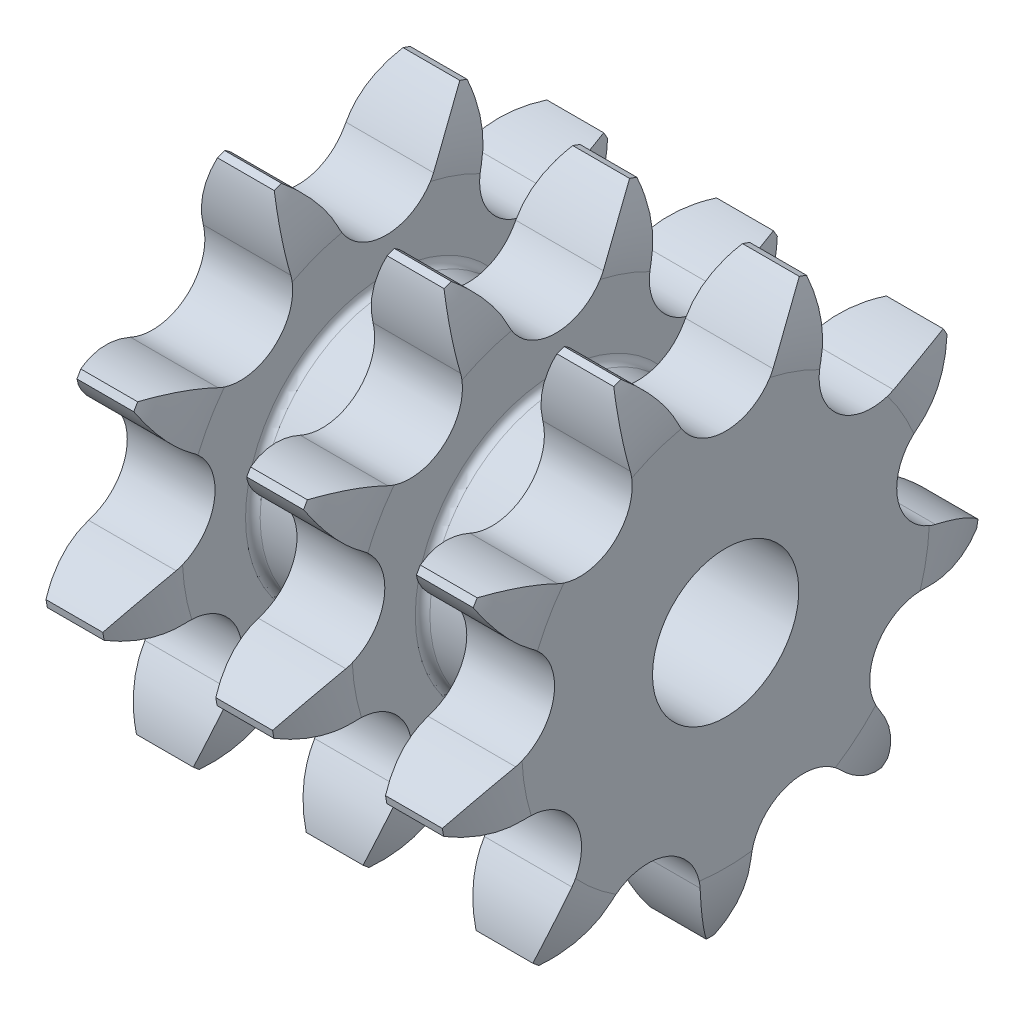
SolidWorks part; units mm, degrees
ref_plane "Plane1" through (0, 0, 0) normal (0, 0, 1) x (1, 0, 0)
ref_plane "Plane2" through (0, 0, 0) normal (0, 1, 0) x (1, 0, 0)
ref_plane "Plane3" through (0, 0, 0) normal (1, 0, 0) x (0, 0, -1)
sketch "Clipboard" plane through (0, 0, 0) normal (0, 1, 0) x (1, 0, 0)
  line L0 (0, 0) -> (12.5436, -1.9867)
  line L1 (-15, 0) -> (100, 0) construction
  line L2 (0, 0) -> (-0.8416, 0.9512)
  line L3 (0, 0) -> (-11.863, 4.5341)
  line L4 (0, 0) -> (3.0618, 0.4849)
  line L5 (0, 0) -> (-2.8109, -1.0484)
  line L6 (0, 0) -> (-29.0469, -19.598)
  line L7 (-0.8416, 0.9512) -> (35.5852, 8.6939)
  line L8 (-76.2, 38.1) -> (-75.2, 38.1)
  line L9 (-73.4259, 41.6592) -> (-72.8306, 41.7344)
  line L10 (-73.4741, 12.7512) -> (-59.5541, 12.7512)
  circle A0 centre (0, 0) radius 4.255
  circle A1 centre (0, 0) radius 10.8715
  circle A2 centre (0, 0) radius 25
sketch "BasProSke" plane through (0, 0, 0) normal (0, 1, 0) x (1, 0, 0)
  line L0 (-10, 0) -> (60, 0) construction
  line L1 (0, 0) -> (0, 16.7129)
  line L2 (0, 0) -> (35.04, 0)
  line L3 (35.04, 0) -> (35.04, 16.7129)
  line L4 (33.77, 22.2487) -> (1.27, 22.2487)
  arc A0 (0, 16.7129) -> (1.27, 22.2487) centre (12.7, 16.7129) cw
  arc A1 (35.04, 16.7129) -> (33.77, 22.2487) centre (22.34, 16.7129) ccw
revolve "Base-Revolve" add sketch "BasProSke" angle 360 about L0
sketch "GrvSke" plane through (0, 0, 0) normal (0, 1, 0) x (1, 0, 0)
  line L0 (7.2, 16.7129) -> (7.2, 11.5305)
  line L1 (7.8, 10.9305) -> (13.32, 10.9305)
  line L2 (13.92, 11.5305) -> (13.92, 16.7129)
  line L3 (5.93, 22.2487) -> (15.19, 22.2487)
  line L4 (10.56, 0) -> (10.56, 52.07) construction
  line L5 (-10, 0) -> (60, 0) construction
  line L6 (0, 0) -> (35.56, 0) construction
  arc A0 (13.92, 16.7129) -> (15.19, 22.2487) centre (26.62, 16.7129) cw
  arc A1 (7.2, 16.7129) -> (5.93, 22.2487) centre (-5.5, 16.7129) ccw
  arc A2 (7.2, 11.5305) -> (7.8, 10.9305) centre (7.8, 11.5305) ccw
  arc A3 (13.32, 10.9305) -> (13.92, 11.5305) centre (13.32, 11.5305) ccw
revolve "Groove" cut sketch "GrvSke" angle 360 about L6
pattern_linear "Grooves" count 2 spacing 13.92 along (1, 0, 0) of "Groove"
sketch "TooCutSke" plane through (0, 0, 0) normal (1, 0, 0) x (0, 0, -1)
  line L0 (0, 18.6087) -> (3.8949, 16.7925) construction
  line L1 (0, 0) -> (0, 107) construction
  line L2 (0, 18.6087) -> (-10, 18.6087) construction
  line L3 (0, 18.6087) -> (-3.8949, 16.7925) construction
  arc A0 (3.8949, 16.7925) -> (7.8075, 21.3669) centre (14.0756, 12.0451) cw
  arc A1 (3.8949, 16.7925) -> (-3.8949, 16.7925) centre (0, 18.6087) cw
  arc A2 (-3.8949, 16.7925) -> (-7.8075, 21.3669) centre (-14.0756, 12.0451) ccw
  arc A3 (7.8075, 21.3669) -> (-7.8075, 21.3669) centre (0, 0) ccw
extrude "ToothCut" cut sketch "TooCutSke" along normal through all
pattern_circular "TeethCuts" count 9 every 40 about axis through (-10, 0, 0) along (1, 0, 0) of "ToothCut"
sketch "HubNeaOneSke" plane through (0, 0, 0) normal (-1, 0, 0) x (0, 0, 1)
  circle A0 centre (0, 0) radius 10.8715
extrude "HubNearOne" [suppressed] add sketch "HubNeaOneSke" along normal blind 2.2005
fillet "HubNearOneFillet" [suppressed] radius 0.6
sketch "HubNeaBotSke" plane through (0, 0, 0) normal (-1, 0, 0) x (0, 0, 1)
  circle A0 centre (0, 0) radius 10.8715
extrude "HubNearBoth" [suppressed] add sketch "HubNeaBotSke" along normal blind 1.1003
fillet "HubNearBothFillet" [suppressed] radius 0.6
ref_plane "FarPln" through (35.04, 0, 0) normal (1, 0, 0) x (0, 0, -1)
sketch "HubFarSke" plane through (35.04, 0, 0) normal (1, 0, 0) x (0, 0, -1)
  circle A0 centre (0, 0) radius 10.8715
extrude "HubFar" [suppressed] add sketch "HubFarSke" along normal blind 1.1003
fillet "HubFarFillet" [suppressed] radius 0.6
sketch "BorSke" plane through (0, 0, 0) normal (1, 0, 0) x (0, 0, -1)
  circle A0 centre (0, 0) radius 6
extrude "Bore" cut sketch "BorSke" along normal mid plane 74.481
sketch "KeySke" plane through (0, 0, 0) normal (1, 0, 0) x (0, 0, -1)
  line L0 (-1, 0) -> (-1, 7)
  line L1 (-1, 7) -> (1, 7)
  line L2 (1, 7) -> (1, 0)
  line L3 (0, 0) -> (0, 34) construction
  line L4 (-1, 0) -> (1, 0)
extrude "Keyway" [suppressed] cut sketch "KeySke" along normal mid plane 74.481
pattern_circular "Keyway2" [suppressed] count 2 every 90 about axis through (-10, 0, 0) along (1, 0, 0)
equation "' \"Pitch@Clipboard\" = 12.7"
equation "' \"Num_strands@Clipboard\" = 3"
equation "' \"Num_teeth@Clipboard\" = 9"
equation "' \"Hub_dia@Clipboard\" = 50"
equation "' \"Overall_len@Clipboard\" = 3"
equation "' \"Diameter@BorSke\" = 12"
equation "' \"T_dim@Clipboard\" = 1"
equation "' \"Width@KeySke\" = 2"
equation "' \"Dr@Clipboard\" = 8.51"
equation "' \"Face_width@Clipboard\" = 7.2"
equation "' \"Side_radius@Clipboard\" = 12.7"
equation "' \"Side_relief@Clipboard\" = 1.27"
equation "' \"Transv_pitch@Clipboard\" = 13.92"
equation "' \"Show_teeth@Clipboard\" = 9"
equation "' \"Fillet_rad@Clipboard\" = 0.6"
equation "' \"Plate_wid@Clipboard\" = 11.8"
equation "\"Num_teeth@Clipboard\" = int( \"Num_teeth@Clipboard\" )"
equation "\"Num_teeth@Clipboard\" = ((sgn( \"Num_teeth@Clipboard\" - 5.0)+1)*( \"Num_teeth@Clipboard\" - 5.0))/2 +5.0"
equation "\"Num_teeth@Clipboard\" = ((sgn( \"Num_teeth@Clipboard\" - 200.0)-1)*( \"Num_teeth@Clipboard\" - 200.0))/-2 +200.0"
equation "\"MHD@Clipboard\" = \"Pitch@Clipboard\" * (1.0 / tan(3.14159265 / \"Num_teeth@Clipboard\" )) - 1.05 * \"Plate_wid@Clipboard\" - 0.76"
equation "\"Thickness@Clipboard\"  = \"Face_width@Clipboard\" + (\"Num_strands@Clipboard\" - 1) * \"Transv_pitch@Clipboard\""
equation "\"OAL@Clipboard\" = \"Thickness@Clipboard\" + 2 * \"Fillet_rad@Clipboard\" + 1"
equation "\"MHD@Clipboard\" = ((sgn( \"MHD@Clipboard\" - \"Hub_dia@Clipboard\" )-1)*( \"MHD@Clipboard\" - \"Hub_dia@Clipboard\" ))/-2+ \"Hub_dia@Clipboard\""
equation "\"OAL@Clipboard\" = ((sgn( \"OAL@Clipboard\" - \"Overall_len@Clipboard\" )+1)*( \"OAL@Clipboard\" - \"Overall_len@Clipboard\" ))/2 + \"Overall_len@Clipboard\" + 0.0005"
equation "\"Num_teeth@TeethCuts\" = int( \"Show_teeth@Clipboard\" ) + 1"
equation "\"Num_teeth@TeethCuts\" = ((sgn( \"Num_teeth@TeethCuts\" - \"Num_teeth@Clipboard\" )-1)*( \"Num_teeth@TeethCuts\" - \"Num_teeth@Clipboard\" ))/-2+ \"Num_teeth@Clipboard\""
equation "\"Num_teeth@TeethCuts\" = ((sgn( \"Num_teeth@TeethCuts\" - 2.0)+1)*( \"Num_teeth@TeethCuts\" - 2.0))/2 +2.0"
equation "\"Angle@TeethCuts\" = 360.0 / \"Num_teeth@Clipboard\""
equation "\"Seat_radius@TooCutSke\" = ( \"Pitch@Clipboard\" / 2.0) / sin(3.14159265 / \"Num_teeth@Clipboard\" ) - \"Dr@Clipboard\" / 2.0 + \"Dr@Clipboard\" * 0.505"
equation "\"R1@TooCutSke\"  = \"Dr@Clipboard\" * 0.505"
equation "\"X@TooCutSke\" = 140.0 - (90.0 / \"Num_teeth@Clipboard\")"
equation "\"R2@TooCutSke\" = 0.12 * \"Dr@Clipboard\" * ( \"Num_teeth@Clipboard\" + 2.0)"
equation "\"Overcut@TooCutSke\" = 0.5 + 0.625 * \"Pitch@Clipboard\" - 0.5 * \"Dr@Clipboard\"  +  \"Pitch@Clipboard\" / 2.0 / sin(3.14159265 / \"Num_teeth@Clipboard\" )"
equation "\"Diameter@BasProSke\" = 2.0 * ( 0.625 * \"Pitch@Clipboard\" - 0.5 * \"Dr@Clipboard\"  +  \"Pitch@Clipboard\" / 2.0 / sin(3.14159265 / \"Num_teeth@Clipboard\" ))"
equation "\"Thickness@BasProSke\"  = \"Thickness@Clipboard\""
equation "\"G1@BasProSke\" =  \"Side_relief@Clipboard\""
equation "\"G2@BasProSke\" =  \"Side_relief@Clipboard\""
equation "\"D1@BasProSke\" =  \"Side_radius@Clipboard\""
equation "\"Diameter@GrvSke\" = \"Diameter@BasProSke\""
equation "\"G1@GrvSke\" = \"Side_relief@Clipboard\""
equation "\"D1@GrvSke\" = \"Side_radius@Clipboard\""
equation "\"Grv_diam@GrvSke\" =  \"Pitch@Clipboard\" * (1.0 / tan(3.14159265 / \"Num_teeth@Clipboard\" ))- 1.04 * \"Plate_wid@Clipboard\" - 0.76"
equation "\"Grv_width@GrvSke\" =  \"Transv_pitch@Clipboard\" - \"Face_width@Clipboard\""
equation "\"Offset@GrvSke\" = \"Grv_width@GrvSke\" / 2.0 + \"Face_width@Clipboard\""
equation "\"Fillet_rad@GrvSke\" = \"Fillet_rad@Clipboard\""
equation "\"Offset@Grooves\" = \"Transv_pitch@Clipboard\""
equation "\"Num_grvs@Grooves\" = \"Num_strands@Clipboard\""
equation "\"Num_grvs@Grooves\" = \"Num_grvs@Grooves\" - 1 * sgn( \"Num_grvs@Grooves\" -1)"
equation "\"Diameter@HubNeaOneSke\" = \"MHD@Clipboard\""
equation "\"Length@HubNearOne\" = \"OAL@Clipboard\" - \"Thickness@BasProSke\""
equation "\"Diameter@HubNeaBotSke\" = \"MHD@Clipboard\""
equation "\"Length@HubNearBoth\" = ( \"OAL@Clipboard\" - \"Thickness@BasProSke\" ) / 2.0"
equation "\"D1@HubNearOneFillet\" = \"Fillet_rad@Clipboard\""
equation "\"D1@HubNearBothFillet\" = \"Fillet_rad@Clipboard\""
equation "\"Thickness@FarPln\" = \"Thickness@BasProSke\""
equation "\"Diameter@HubFarSke\" = \"MHD@Clipboard\""
equation "\"Length@HubFar\" = ( \"OAL@Clipboard\" - \"Thickness@BasProSke\" ) / 2.0"
equation "\"D1@HubFarFillet\" = \"Fillet_rad@Clipboard\""
equation "\"D1@Bore\" = \"OAL@Clipboard\" * 2.0"
equation "\"D1@Keyway\" = \"OAL@Clipboard\" * 2.0"
equation "\"Offset@KeySke\" = \"T_dim@Clipboard\" + \"Diameter@BorSke\" / 2.0"
